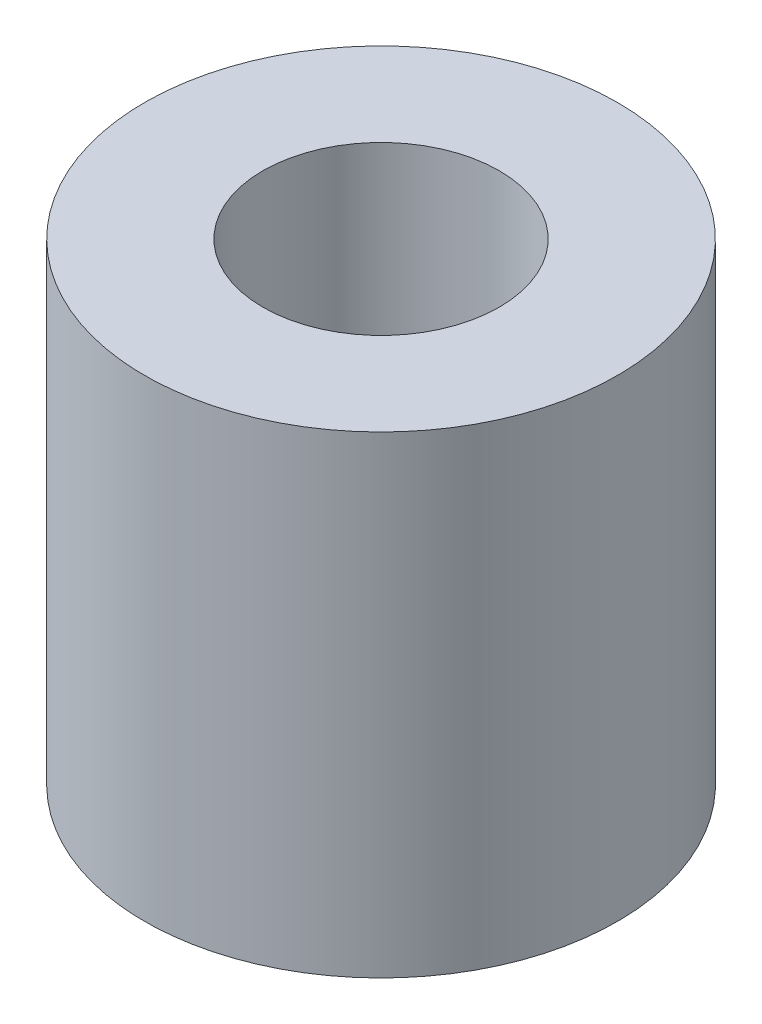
SolidWorks part; units mm, degrees
ref_plane "Front Plane" through (0, 0, 0) normal (0, 0, 1) x (1, 0, 0)
ref_plane "Top Plane" through (0, 0, 0) normal (0, 1, 0) x (1, 0, 0)
ref_plane "Right Plane" through (0, 0, 0) normal (1, 0, 0) x (0, 0, -1)
sketch "Sketch1" plane through (0, 0, 0) normal (0, 0, 1) x (1, 0, 0)
  line L0 (2.5, 5) -> (5, 5)
  line L1 (5, 5) -> (5, -5)
  line L2 (5, -5) -> (3.175, -5)
  line L3 (3.175, -5) -> (3.175, 0)
  line L4 (3.175, 0) -> (2.5, 0)
  line L5 (2.5, 0) -> (2.5, 5)
  line L6 (0, 0) -> (0, 6.9159) construction
  dimension "D1" = 2.5
  dimension "D2" = 3.175
  dimension "D3" = 5
  dimension "D4" = 5
  dimension "D5" = 5
revolve "Revolve1" add sketch "Sketch1" angle 360 about L6
sketch "Sketch2" plane through (0, 0, 0) normal (0, 0, 1) x (1, 0, 0)
  circle A0 centre (0, 2.4646) radius 0.5725
